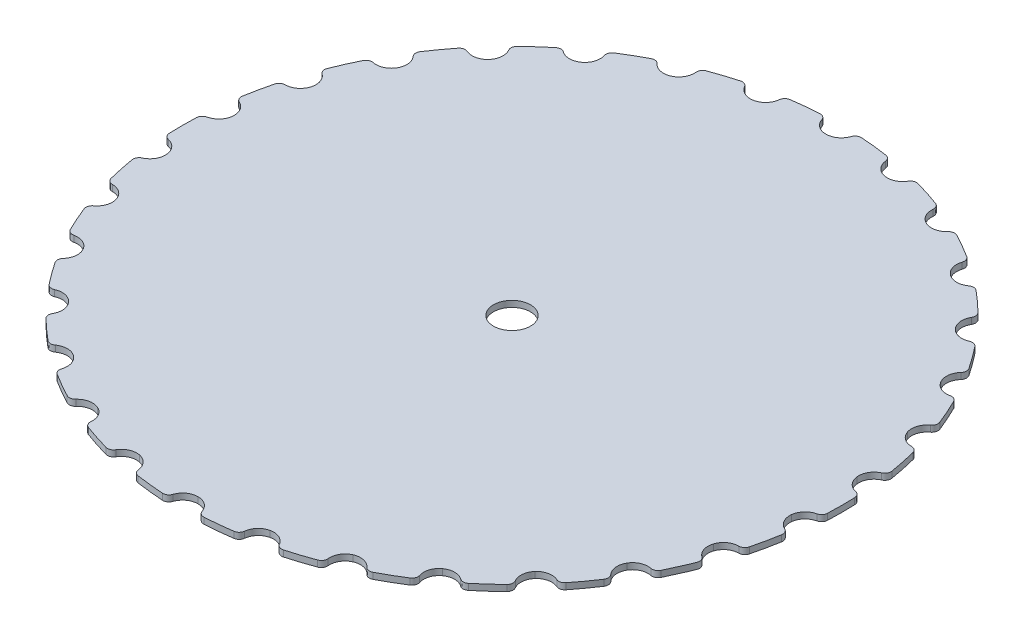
SolidWorks part; units mm, degrees
ref_plane "Front Plane" through (0, 0, 0) normal (0, 0, 1) x (1, 0, 0)
ref_plane "Top Plane" through (0, 0, 0) normal (0, 1, 0) x (1, 0, 0)
ref_plane "Right Plane" through (0, 0, 0) normal (1, 0, 0) x (0, 0, -1)
sketch "Sketch1" plane through (0, 0, 0) normal (0, 1, 0) x (1, 0, 0)
  circle A0 centre (6.5945, 0.258) radius 3
  ellipse E0 centre (6.5945, 0.258) end of major axis (6.5945, 3.258) minor radius 3 construction
  spline S0 degree 3 poles (-30.729, 38.4268) (-29.6819, 39.4503) (-28.5937, 40.4313) (-27.4664, 41.3656) (-27.1101, 41.6609) (-26.6154, 41.6768) (-26.2409, 41.405) knots 0.986667 0.986667 0.986667 0.986667 0.993333 0.993333 0.993333 1 1 1 1
  spline S1 degree 3 poles (-30.8964, 37.2123) (-31.1274, 37.6132) (-31.0598, 38.1034) (-30.729, 38.4268) knots 0.98 0.98 0.98 0.98 0.986667 0.986667 0.986667 0.986667
  spline S2 degree 3 poles (-31.2051, 34.2913) (-30.4625, 35.1163) (-30.3707, 36.2999) (-30.8964, 37.2123) knots 0.973333 0.973333 0.973333 0.973333 0.98 0.98 0.98 0.98
  spline S3 degree 3 poles (-35.274, 33.3879) (-34.9865, 33.7513) (-34.5051, 33.8694) (-34.082, 33.6805) (-33.1189, 33.2505) (-31.949, 33.4652) (-31.2051, 34.2913) knots 0.96 0.96 0.96 0.96 0.966667 0.966667 0.966667 0.973333 0.973333 0.973333 0.973333
  spline S4 degree 3 poles (-37.8517, 29.8338) (-37.0459, 31.0474) (-36.187, 32.2337) (-35.274, 33.3879) knots 0.953333 0.953333 0.953333 0.953333 0.96 0.96 0.96 0.96
  spline S5 degree 3 poles (-37.7617, 28.6114) (-38.0713, 28.9552) (-38.1076, 29.4484) (-37.8517, 29.8338) knots 0.946667 0.946667 0.946667 0.946667 0.953333 0.953333 0.953333 0.953333
  spline S6 degree 3 poles (-37.455, 25.6887) (-36.8997, 26.6506) (-37.0564, 27.8284) (-37.7617, 28.6114) knots 0.94 0.94 0.94 0.94 0.946667 0.946667 0.946667 0.946667
  spline S7 degree 3 poles (-40.1346, 24.4915) (-39.1054, 24.2749) (-38.0095, 24.7282) (-37.455, 25.6887) knots 0.933333 0.933333 0.933333 0.933333 0.94 0.94 0.94 0.94
  spline S8 degree 3 poles (-41.2374, 23.9554) (-41.0326, 24.3705) (-40.5875, 24.5868) (-40.1346, 24.4915) knots 0.926667 0.926667 0.926667 0.926667 0.933333 0.933333 0.933333 0.933333
  spline S9 degree 3 poles (-43.0169, 19.9362) (-42.4804, 21.2962) (-41.8875, 22.6375) (-41.2374, 23.9554) knots 0.92 0.92 0.92 0.92 0.926667 0.926667 0.926667 0.926667
  spline S10 degree 3 poles (-41.7798, 15.9745) (-41.4379, 17.0269) (-41.832, 18.1421) (-42.6781, 18.7629) (-43.0495, 19.0354) (-43.1859, 19.5077) (-43.0169, 19.9362) knots 0.906667 0.906667 0.906667 0.906667 0.913333 0.913333 0.913333 0.92 0.92 0.92 0.92
  spline S11 degree 3 poles (-44.1383, 14.2464) (-43.0915, 14.2541) (-42.1209, 14.9243) (-41.7798, 15.9745) knots 0.9 0.9 0.9 0.9 0.906667 0.906667 0.906667 0.906667
  spline S12 degree 3 poles (-45.0998, 13.4933) (-44.986, 13.9398) (-44.5989, 14.2429) (-44.1383, 14.2464) knots 0.893333 0.893333 0.893333 0.893333 0.9 0.9 0.9 0.9
  spline S13 degree 3 poles (-46.011, 9.187) (-45.7664, 10.6331) (-45.4624, 12.0698) (-45.0998, 13.4933) knots 0.886667 0.886667 0.886667 0.886667 0.893333 0.893333 0.893333 0.893333
  spline S14 degree 3 poles (-45.4396, 8.1102) (-45.8578, 8.3008) (-46.0877, 8.7338) (-46.011, 9.187) knots 0.88 0.88 0.88 0.88 0.886667 0.886667 0.886667 0.886667
  spline S15 degree 3 poles (-43.9903, 5.5735) (-43.8751, 6.6705) (-44.4879, 7.6767) (-45.4396, 8.1102) knots 0.873333 0.873333 0.873333 0.873333 0.88 0.88 0.88 0.88
  spline S16 degree 3 poles (-45.9348, 3.3935) (-44.9142, 3.6199) (-44.1056, 4.4764) (-43.9903, 5.5735) knots 0.866667 0.866667 0.866667 0.866667 0.873333 0.873333 0.873333 0.873333
  spline S17 degree 3 poles (-46.7175, 2.4591) (-46.6982, 2.9183) (-46.3835, 3.294) (-45.9348, 3.3935) knots 0.86 0.86 0.86 0.86 0.866667 0.866667 0.866667 0.866667
  spline S18 degree 3 poles (-46.7215, -1.9428) (-46.7801, -0.475) (-46.7789, 0.9937) (-46.7175, 2.4591) knots 0.853333 0.853333 0.853333 0.853333 0.86 0.86 0.86 0.86
  spline S19 degree 3 poles (-45.9377, -2.8794) (-46.3875, -2.7802) (-46.7031, -2.4031) (-46.7215, -1.9428) knots 0.846667 0.846667 0.846667 0.846667 0.853333 0.853333 0.853333 0.853333
  spline S20 degree 3 poles (-43.99, -5.0598) (-44.1055, -3.9618) (-44.9156, -3.1047) (-45.9377, -2.8794) knots 0.84 0.84 0.84 0.84 0.846667 0.846667 0.846667 0.846667
  spline S21 degree 3 poles (-45.4489, -7.6011) (-44.4919, -7.1699) (-43.8744, -6.1608) (-43.99, -5.0598) knots 0.833333 0.833333 0.833333 0.833333 0.84 0.84 0.84 0.84
  spline S22 degree 3 poles (-46.0244, -8.6785) (-46.1007, -8.2242) (-45.869, -7.7903) (-45.4489, -7.6011) knots 0.826667 0.826667 0.826667 0.826667 0.833333 0.833333 0.833333 0.833333
  spline S23 degree 3 poles (-45.1181, -12.9794) (-45.4801, -11.5553) (-45.7824, -10.1202) (-46.0244, -8.6785) knots 0.82 0.82 0.82 0.82 0.826667 0.826667 0.826667 0.826667
  spline S24 degree 3 poles (-44.151, -13.7328) (-44.6137, -13.7318) (-45.0041, -13.4277) (-45.1181, -12.9794) knots 0.813333 0.813333 0.813333 0.813333 0.82 0.82 0.82 0.82
  spline S25 degree 3 poles (-41.7789, -15.4608) (-42.1217, -14.4062) (-43.0991, -13.735) (-44.151, -13.7328) knots 0.806667 0.806667 0.806667 0.806667 0.813333 0.813333 0.813333 0.813333
  spline S26 degree 3 poles (-42.6873, -18.2567) (-41.8342, -17.6374) (-41.4356, -16.5176) (-41.7789, -15.4608) knots 0.8 0.8 0.8 0.8 0.806667 0.806667 0.806667 0.806667
  spline S27 degree 3 poles (-43.0295, -19.434) (-43.1998, -19.0037) (-43.0618, -18.5286) (-42.6873, -18.2567) knots 0.793333 0.793333 0.793333 0.793333 0.8 0.8 0.8 0.8
  spline S28 degree 3 poles (-41.2452, -23.4453) (-41.8987, -22.1268) (-42.4933, -20.7882) (-43.0295, -19.434) knots 0.786667 0.786667 0.786667 0.786667 0.793333 0.793333 0.793333 0.793333
  spline S29 degree 3 poles (-40.1404, -23.9792) (-40.5934, -24.0759) (-41.0396, -23.8603) (-41.2452, -23.4453) knots 0.78 0.78 0.78 0.78 0.786667 0.786667 0.786667 0.786667
  spline S30 degree 3 poles (-37.4537, -25.1746) (-38.0095, -24.2122) (-39.109, -23.7591) (-40.1404, -23.9792) knots 0.773333 0.773333 0.773333 0.773333 0.78 0.78 0.78 0.78
  spline S31 degree 3 poles (-37.76, -28.0974) (-37.055, -27.3142) (-36.8985, -26.1366) (-37.4537, -25.1746) knots 0.766667 0.766667 0.766667 0.766667 0.773333 0.773333 0.773333 0.773333
  spline S32 degree 3 poles (-37.8487, -29.3214) (-38.1058, -28.936) (-38.07, -28.4417) (-37.76, -28.0974) knots 0.76 0.76 0.76 0.76 0.766667 0.766667 0.766667 0.766667
  spline S33 degree 3 poles (-35.2635, -32.8705) (-36.1744, -31.7202) (-37.0343, -30.542) (-37.8487, -29.3214) knots 0.753333 0.753333 0.753333 0.753333 0.76 0.76 0.76 0.76
  spline S34 degree 3 poles (-34.0743, -33.1639) (-34.4969, -33.3512) (-34.9766, -33.2329) (-35.2635, -32.8705) knots 0.746667 0.746667 0.746667 0.746667 0.753333 0.753333 0.753333 0.753333
  spline S35 degree 3 poles (-31.2033, -33.777) (-31.9458, -32.9528) (-33.1123, -32.7374) (-34.0743, -33.1639) knots 0.74 0.74 0.74 0.74 0.746667 0.746667 0.746667 0.746667
  spline S36 degree 3 poles (-30.7285, -37.9137) (-31.0591, -37.5901) (-31.1263, -37.1) (-30.8951, -36.6993) (-30.3686, -35.7868) (-30.4602, -34.6026) (-31.2033, -33.777) knots 0.726667 0.726667 0.726667 0.726667 0.733333 0.733333 0.733333 0.74 0.74 0.74 0.74
  spline S37 degree 3 poles (-27.4666, -40.8529) (-28.5865, -39.9246) (-29.6752, -38.9448) (-30.7285, -37.9137) knots 0.72 0.72 0.72 0.72 0.726667 0.726667 0.726667 0.726667
  spline S38 degree 3 poles (-26.2405, -40.8918) (-26.615, -41.1641) (-27.1101, -41.1484) (-27.4666, -40.8529) knots 0.713333 0.713333 0.713333 0.713333 0.72 0.72 0.72 0.72
  spline S39 degree 3 poles (-23.3011, -40.8919) (-24.1999, -40.2391) (-25.3879, -40.2719) (-26.2405, -40.8918) knots 0.706667 0.706667 0.706667 0.706667 0.713333 0.713333 0.713333 0.713333
  spline S40 degree 3 poles (-21.9756, -44.8409) (-22.3672, -44.5934) (-22.5354, -44.1273) (-22.3922, -43.6867) (-22.0665, -42.6846) (-22.4024, -41.545) (-23.3011, -40.8919) knots 0.693333 0.693333 0.693333 0.693333 0.7 0.7 0.7 0.706667 0.706667 0.706667 0.706667
  spline S41 degree 3 poles (-18.1687, -47.0319) (-19.4625, -46.357) (-20.7328, -45.6266) (-21.9756, -44.8409) knots 0.686667 0.686667 0.686667 0.686667 0.693333 0.693333 0.693333 0.693333
  spline S42 degree 3 poles (-16.9642, -46.8157) (-17.2738, -47.1583) (-17.7593, -47.2455) (-18.1687, -47.0319) knots 0.68 0.68 0.68 0.68 0.686667 0.686667 0.686667 0.686667
  spline S43 degree 3 poles (-14.0922, -46.2083) (-15.1056, -45.7573) (-16.2588, -46.0349) (-16.9642, -46.8157) knots 0.673333 0.673333 0.673333 0.673333 0.68 0.68 0.68 0.68
  spline S44 degree 3 poles (-12.6208, -48.7404) (-12.5165, -47.6968) (-13.0815, -46.6585) (-14.0922, -46.2083) knots 0.666667 0.666667 0.666667 0.666667 0.673333 0.673333 0.673333 0.673333
  spline S45 degree 3 poles (-11.972, -49.778) (-12.4051, -49.6181) (-12.6666, -49.1998) (-12.6208, -48.7404) knots 0.66 0.66 0.66 0.66 0.666667 0.666667 0.666667 0.666667
  spline S46 degree 3 poles (-7.786, -51.1305) (-9.1969, -50.7377) (-10.5936, -50.2867) (-11.972, -49.778) knots 0.653333 0.653333 0.653333 0.653333 0.66 0.66 0.66 0.66
  spline S47 degree 3 poles (-6.6554, -50.6733) (-6.8882, -51.0699) (-7.343, -51.2538) (-7.786, -51.1305) knots 0.646667 0.646667 0.646667 0.646667 0.653333 0.653333 0.653333 0.653333
  spline S48 degree 3 poles (-3.9792, -49.494) (-5.0596, -49.2645) (-6.1253, -49.7704) (-6.6554, -50.6733) knots 0.64 0.64 0.64 0.64 0.646667 0.646667 0.646667 0.646667
  spline S49 degree 3 poles (-2.0144, -51.6557) (-2.1328, -50.617) (-2.9001, -49.7233) (-3.9792, -49.494) knots 0.633333 0.633333 0.633333 0.633333 0.64 0.64 0.64 0.64
  spline S50 degree 3 poles (-1.166, -52.5319) (-1.6211, -52.4651) (-1.9623, -52.1127) (-2.0144, -51.6557) knots 0.626667 0.626667 0.626667 0.626667 0.633333 0.633333 0.633333 0.633333
  spline S51 degree 3 poles (3.2123, -52.9924) (1.7473, -52.8986) (0.2864, -52.745) (-1.166, -52.5319) knots 0.62 0.62 0.62 0.62 0.626667 0.626667 0.626667 0.626667
  spline S52 degree 3 poles (4.2244, -52.3117) (4.0785, -52.7479) (3.6713, -53.0218) (3.2123, -52.9924) knots 0.613333 0.613333 0.613333 0.613333 0.62 0.62 0.62 0.62
  spline S53 degree 3 poles (6.5959, -50.6052) (5.4926, -50.6053) (4.5562, -51.3199) (4.2244, -52.3117) knots 0.606667 0.606667 0.606667 0.606667 0.613333 0.613333 0.613333 0.613333
  spline S54 degree 3 poles (8.9689, -52.316) (8.6386, -51.322) (7.7009, -50.6053) (6.5959, -50.6052) knots 0.6 0.6 0.6 0.6 0.606667 0.606667 0.606667 0.606667
  spline S55 degree 3 poles (9.9798, -52.9988) (9.5207, -53.0273) (9.1141, -52.7526) (8.9689, -52.316) knots 0.593333 0.593333 0.593333 0.593333 0.6 0.6 0.6 0.6
  spline S56 degree 3 poles (14.3547, -52.5464) (12.901, -52.7573) (11.4412, -52.9081) (9.9798, -52.9988) knots 0.586667 0.586667 0.586667 0.586667 0.593333 0.593333 0.593333 0.593333
  spline S57 degree 3 poles (15.2051, -51.6659) (15.1547, -52.125) (14.8118, -52.4801) (14.3547, -52.5464) knots 0.58 0.58 0.58 0.58 0.586667 0.586667 0.586667 0.586667
  spline S58 degree 3 poles (17.171, -49.4934) (16.0883, -49.7235) (15.3195, -50.6225) (15.2051, -51.6659) knots 0.573333 0.573333 0.573333 0.573333 0.58 0.58 0.58 0.58
  spline S59 degree 3 poles (19.8545, -50.6853) (19.3272, -49.7744) (18.2565, -49.2627) (17.171, -49.4934) knots 0.566667 0.566667 0.566667 0.566667 0.573333 0.573333 0.573333 0.573333
  spline S60 degree 3 poles (20.9881, -51.1478) (20.543, -51.2716) (20.0859, -51.0852) (19.8545, -50.6853) knots 0.56 0.56 0.56 0.56 0.566667 0.566667 0.566667 0.566667
  spline S61 degree 3 poles (25.1664, -49.7959) (23.7878, -50.3059) (22.3936, -50.7566) (20.9881, -51.1478) knots 0.553333 0.553333 0.553333 0.553333 0.56 0.56 0.56 0.56
  spline S62 degree 3 poles (25.8138, -48.7531) (25.8625, -49.2139) (25.601, -49.6351) (25.1664, -49.7959) knots 0.546667 0.546667 0.546667 0.546667 0.553333 0.553333 0.553333 0.553333
  spline S63 degree 3 poles (27.2838, -46.2072) (26.2688, -46.6592) (25.7033, -47.7047) (25.8138, -48.7531) knots 0.54 0.54 0.54 0.54 0.546667 0.546667 0.546667 0.546667
  spline S64 degree 3 poles (30.1603, -46.8195) (29.4554, -46.0349) (28.2994, -45.7551) (27.2838, -46.2072) knots 0.533333 0.533333 0.533333 0.533333 0.54 0.54 0.54 0.54
  spline S65 degree 3 poles (31.3684, -47.0369) (30.9579, -47.252) (30.47, -47.1643) (30.1603, -46.8195) knots 0.526667 0.526667 0.526667 0.526667 0.533333 0.533333 0.533333 0.533333
  spline S66 degree 3 poles (35.1688, -44.8401) (33.9245, -45.6298) (32.6563, -46.362) (31.3684, -47.0369) knots 0.52 0.52 0.52 0.52 0.526667 0.526667 0.526667 0.526667
  spline S67 degree 3 poles (35.5839, -43.6863) (35.7271, -44.1264) (35.5596, -44.5921) (35.1688, -44.8401) knots 0.513333 0.513333 0.513333 0.513333 0.52 0.52 0.52 0.52
  spline S68 degree 3 poles (36.4923, -40.8903) (35.5935, -41.5436) (35.2578, -42.6837) (35.5839, -43.6863) knots 0.506667 0.506667 0.506667 0.506667 0.513333 0.513333 0.513333 0.513333
  spline S69 degree 3 poles (39.43, -40.8887) (38.5777, -40.27) (37.3907, -40.2377) (36.4923, -40.8903) knots 0.5 0.5 0.5 0.5 0.506667 0.506667 0.506667 0.506667
  spline S70 degree 3 poles (40.6555, -40.8494) (40.2992, -41.1447) (39.8045, -41.1606) (39.43, -40.8887) knots 0.493333 0.493333 0.493333 0.493333 0.5 0.5 0.5 0.5
  spline S71 degree 3 poles (43.918, -37.9106) (42.8709, -38.9339) (41.7827, -39.9152) (40.6555, -40.8494) knots 0.486667 0.486667 0.486667 0.486667 0.493333 0.493333 0.493333 0.493333
  spline S72 degree 3 poles (44.0854, -36.6962) (44.3164, -37.0971) (44.2489, -37.5872) (43.918, -37.9106) knots 0.48 0.48 0.48 0.48 0.486667 0.486667 0.486667 0.486667
  spline S73 degree 3 poles (44.3943, -33.775) (43.6516, -34.6001) (43.5596, -35.7838) (44.0854, -36.6962) knots 0.473333 0.473333 0.473333 0.473333 0.48 0.48 0.48 0.48
  spline S74 degree 3 poles (47.2711, -33.1643) (46.3079, -32.7342) (45.1382, -32.9489) (44.3943, -33.775) knots 0.466667 0.466667 0.466667 0.466667 0.473333 0.473333 0.473333 0.473333
  spline S75 degree 3 poles (48.4631, -32.8716) (48.1756, -33.235) (47.6942, -33.3532) (47.2711, -33.1643) knots 0.46 0.46 0.46 0.46 0.466667 0.466667 0.466667 0.466667
  spline S76 degree 3 poles (51.0407, -29.3178) (50.2349, -30.5312) (49.3761, -31.7175) (48.4631, -32.8716) knots 0.453333 0.453333 0.453333 0.453333 0.46 0.46 0.46 0.46
  spline S77 degree 3 poles (50.9507, -28.0954) (51.2603, -28.4391) (51.2966, -28.9324) (51.0407, -29.3178) knots 0.446667 0.446667 0.446667 0.446667 0.453333 0.453333 0.453333 0.453333
  spline S78 degree 3 poles (50.6441, -25.1723) (50.0888, -26.1344) (50.2455, -27.3123) (50.9507, -28.0954) knots 0.44 0.44 0.44 0.44 0.446667 0.446667 0.446667 0.446667
  spline S79 degree 3 poles (53.3236, -23.9753) (52.2943, -23.7586) (51.1987, -24.2119) (50.6441, -25.1723) knots 0.433333 0.433333 0.433333 0.433333 0.44 0.44 0.44 0.44
  spline S80 degree 3 poles (54.4264, -23.4391) (54.2216, -23.8542) (53.7765, -24.0705) (53.3236, -23.9753) knots 0.426667 0.426667 0.426667 0.426667 0.433333 0.433333 0.433333 0.433333
  spline S81 degree 3 poles (54.9689, -15.4582) (54.627, -16.5108) (55.0208, -17.6261) (55.867, -18.2469) (56.2383, -18.5193) (56.3748, -18.9917) (56.2058, -19.4201) (55.6693, -20.7801) (55.0765, -22.1213) (54.4264, -23.4391) knots 0.406667 0.406667 0.406667 0.406667 0.413333 0.413333 0.413333 0.42 0.42 0.42 0.426667 0.426667 0.426667 0.426667
  spline S82 degree 3 poles (57.3272, -13.7302) (56.2805, -13.738) (55.3102, -14.408) (54.9689, -15.4582) knots 0.4 0.4 0.4 0.4 0.406667 0.406667 0.406667 0.406667
  spline S83 degree 3 poles (58.2888, -12.9771) (58.1751, -13.4235) (57.7879, -13.7267) (57.3272, -13.7302) knots 0.393333 0.393333 0.393333 0.393333 0.4 0.4 0.4 0.4
  spline S84 degree 3 poles (59.2, -8.6709) (58.9553, -10.117) (58.6514, -11.5537) (58.2888, -12.9771) knots 0.386667 0.386667 0.386667 0.386667 0.393333 0.393333 0.393333 0.393333
  spline S85 degree 3 poles (58.6287, -7.5941) (59.0469, -7.7847) (59.2767, -8.2177) (59.2, -8.6709) knots 0.38 0.38 0.38 0.38 0.386667 0.386667 0.386667 0.386667
  spline S86 degree 3 poles (57.1794, -5.0572) (57.0642, -6.1544) (57.677, -7.1605) (58.6287, -7.5941) knots 0.373333 0.373333 0.373333 0.373333 0.38 0.38 0.38 0.38
  spline S87 degree 3 poles (59.1238, -2.8772) (58.1031, -3.1035) (57.2948, -3.9601) (57.1794, -5.0572) knots 0.366667 0.366667 0.366667 0.366667 0.373333 0.373333 0.373333 0.373333
  spline S88 degree 3 poles (59.9065, -1.9429) (59.8872, -2.4021) (59.5725, -2.7777) (59.1238, -2.8772) knots 0.36 0.36 0.36 0.36 0.366667 0.366667 0.366667 0.366667
  spline S89 degree 3 poles (59.9105, 2.4589) (59.9691, 0.9911) (59.9679, -0.4776) (59.9065, -1.9429) knots 0.353333 0.353333 0.353333 0.353333 0.36 0.36 0.36 0.36
  spline S90 degree 3 poles (59.1267, 3.3955) (59.5765, 3.2963) (59.8921, 2.9192) (59.9105, 2.4589) knots 0.346667 0.346667 0.346667 0.346667 0.353333 0.353333 0.353333 0.353333
  spline S91 degree 3 poles (57.1791, 5.5761) (57.2945, 4.478) (58.1046, 3.6209) (59.1267, 3.3955) knots 0.34 0.34 0.34 0.34 0.346667 0.346667 0.346667 0.346667
  spline S92 degree 3 poles (58.6379, 8.1173) (57.6809, 7.6862) (57.0634, 6.677) (57.1791, 5.5761) knots 0.333333 0.333333 0.333333 0.333333 0.34 0.34 0.34 0.34
  spline S93 degree 3 poles (59.2134, 9.1947) (59.2897, 8.7403) (59.058, 8.3065) (58.6379, 8.1173) knots 0.326667 0.326667 0.326667 0.326667 0.333333 0.333333 0.333333 0.333333
  spline S94 degree 3 poles (58.3071, 13.4955) (58.6692, 12.0714) (58.9713, 10.6364) (59.2134, 9.1947) knots 0.32 0.32 0.32 0.32 0.326667 0.326667 0.326667 0.326667
  spline S95 degree 3 poles (57.3401, 14.249) (57.8028, 14.248) (58.1931, 13.9439) (58.3071, 13.4955) knots 0.313333 0.313333 0.313333 0.313333 0.32 0.32 0.32 0.32
  spline S96 degree 3 poles (54.968, 15.9771) (55.3107, 14.9225) (56.2882, 14.2511) (57.3401, 14.249) knots 0.306667 0.306667 0.306667 0.306667 0.313333 0.313333 0.313333 0.313333
  spline S97 degree 3 poles (55.8763, 18.7729) (55.0231, 18.1537) (54.6246, 17.0338) (54.968, 15.9771) knots 0.3 0.3 0.3 0.3 0.306667 0.306667 0.306667 0.306667
  spline S98 degree 3 poles (56.2187, 19.9503) (56.3891, 19.5199) (56.2509, 19.0448) (55.8763, 18.7729) knots 0.293333 0.293333 0.293333 0.293333 0.3 0.3 0.3 0.3
  spline S99 degree 3 poles (54.4343, 23.9616) (55.0878, 22.643) (55.6826, 21.3046) (56.2187, 19.9503) knots 0.286667 0.286667 0.286667 0.286667 0.293333 0.293333 0.293333 0.293333
  spline S100 degree 3 poles (53.3295, 24.4954) (53.7825, 24.5922) (54.2286, 24.3766) (54.4343, 23.9616) knots 0.28 0.28 0.28 0.28 0.286667 0.286667 0.286667 0.286667
  spline S101 degree 3 poles (50.6428, 25.691) (51.1986, 24.7284) (52.2982, 24.2752) (53.3295, 24.4954) knots 0.273333 0.273333 0.273333 0.273333 0.28 0.28 0.28 0.28
  spline S102 degree 3 poles (50.9492, 28.6138) (50.244, 27.8307) (50.0873, 26.653) (50.6428, 25.691) knots 0.266667 0.266667 0.266667 0.266667 0.273333 0.273333 0.273333 0.273333
  spline S103 degree 3 poles (51.0382, 29.8376) (51.2951, 29.4522) (51.2592, 28.958) (50.9492, 28.6138) knots 0.26 0.26 0.26 0.26 0.266667 0.266667 0.266667 0.266667
  spline S104 degree 3 poles (48.4548, 33.3879) (49.3642, 32.2402) (50.2259, 31.0561) (51.0382, 29.8376) knots 0.253333 0.253333 0.253333 0.253333 0.26 0.26 0.26 0.26
  spline S105 degree 3 poles (47.2651, 33.6807) (47.6877, 33.8684) (48.1677, 33.7503) (48.4548, 33.3879) knots 0.246667 0.246667 0.246667 0.246667 0.253333 0.253333 0.253333 0.253333
  spline S106 degree 3 poles (44.3925, 34.2933) (45.1352, 33.4685) (46.3028, 33.2532) (47.2651, 33.6807) knots 0.24 0.24 0.24 0.24 0.246667 0.246667 0.246667 0.246667
  spline S107 degree 3 poles (44.0845, 37.2161) (43.5575, 36.3035) (43.649, 35.1188) (44.3925, 34.2933) knots 0.233333 0.233333 0.233333 0.233333 0.24 0.24 0.24 0.24
  spline S108 degree 3 poles (43.918, 38.4307) (44.2487, 38.107) (44.3159, 37.6168) (44.0845, 37.2161) knots 0.226667 0.226667 0.226667 0.226667 0.233333 0.233333 0.233333 0.233333
  spline S109 degree 3 poles (40.6566, 41.3696) (41.7763, 40.4415) (42.8648, 39.4618) (43.918, 38.4307) knots 0.22 0.22 0.22 0.22 0.226667 0.226667 0.226667 0.226667
  spline S110 degree 3 poles (39.4302, 41.4083) (39.8048, 41.6808) (40.3, 41.6652) (40.6566, 41.3696) knots 0.213333 0.213333 0.213333 0.213333 0.22 0.22 0.22 0.22
  spline S111 degree 3 poles (36.4902, 41.4082) (37.3891, 40.7551) (38.5777, 40.7882) (39.4302, 41.4083) knots 0.206667 0.206667 0.206667 0.206667 0.213333 0.213333 0.213333 0.213333
  spline S112 degree 3 poles (35.5813, 44.2029) (35.2556, 43.2007) (35.5914, 42.0611) (36.4902, 41.4082) knots 0.2 0.2 0.2 0.2 0.206667 0.206667 0.206667 0.206667
  spline S113 degree 3 poles (35.1647, 45.3571) (35.5562, 45.1095) (35.7244, 44.6434) (35.5813, 44.2029) knots 0.193333 0.193333 0.193333 0.193333 0.2 0.2 0.2 0.2
  spline S114 degree 3 poles (31.3581, 47.5484) (32.6518, 46.8734) (33.9219, 46.1427) (35.1647, 45.3571) knots 0.186667 0.186667 0.186667 0.186667 0.193333 0.193333 0.193333 0.193333
  spline S115 degree 3 poles (30.1534, 47.3321) (30.463, 47.6748) (30.9487, 47.7621) (31.3581, 47.5484) knots 0.18 0.18 0.18 0.18 0.186667 0.186667 0.186667 0.186667
  spline S116 degree 3 poles (27.2813, 46.7247) (28.2948, 46.2737) (29.448, 46.5513) (30.1534, 47.3321) knots 0.173333 0.173333 0.173333 0.173333 0.18 0.18 0.18 0.18
  spline S117 degree 3 poles (25.8099, 49.2573) (25.7052, 48.2133) (26.2703, 47.1746) (27.2813, 46.7247) knots 0.166667 0.166667 0.166667 0.166667 0.173333 0.173333 0.173333 0.173333
  spline S118 degree 3 poles (25.1612, 50.2953) (25.5945, 50.1353) (25.8559, 49.7169) (25.8099, 49.2573) knots 0.16 0.16 0.16 0.16 0.166667 0.166667 0.166667 0.166667
  spline S119 degree 3 poles (20.9756, 51.6476) (22.3864, 51.2549) (23.783, 50.8041) (25.1612, 50.2953) knots 0.153333 0.153333 0.153333 0.153333 0.16 0.16 0.16 0.16
  spline S120 degree 3 poles (19.8449, 51.1902) (20.0776, 51.5869) (20.5325, 51.7709) (20.9756, 51.6476) knots 0.146667 0.146667 0.146667 0.146667 0.153333 0.153333 0.153333 0.153333
  spline S121 degree 3 poles (17.1683, 50.0103) (18.249, 49.7806) (19.3149, 50.2868) (19.8449, 51.1902) knots 0.14 0.14 0.14 0.14 0.146667 0.146667 0.146667 0.146667
  spline S122 degree 3 poles (15.2035, 52.172) (15.3219, 51.1331) (16.089, 50.2395) (17.1683, 50.0103) knots 0.133333 0.133333 0.133333 0.133333 0.14 0.14 0.14 0.14
  spline S123 degree 3 poles (9.9765, 53.5084) (11.4417, 53.4148) (12.9025, 53.2611) (14.3551, 53.0482) (14.8102, 52.9815) (15.1514, 52.629) (15.2035, 52.172) knots 0.12 0.12 0.12 0.12 0.126667 0.126667 0.126667 0.133333 0.133333 0.133333 0.133333
  spline S124 degree 3 poles (8.9645, 52.8278) (9.1105, 53.2639) (9.5175, 53.5377) (9.9765, 53.5084) knots 0.113333 0.113333 0.113333 0.113333 0.12 0.12 0.12 0.12
  spline S125 degree 3 poles (4.2203, 52.8321) (4.5506, 51.8383) (5.4883, 51.1215) (6.5932, 51.1215) (7.6964, 51.1215) (8.6327, 51.8363) (8.9645, 52.8278) knots 0.1 0.1 0.1 0.1 0.106667 0.106667 0.106667 0.113333 0.113333 0.113333 0.113333
  spline S126 degree 3 poles (3.2093, 53.5148) (3.6684, 53.5433) (4.0752, 53.2686) (4.2203, 52.8321) knots 0.093333 0.093333 0.093333 0.093333 0.1 0.1 0.1 0.1
  spline S127 degree 3 poles (-1.1658, 53.0621) (0.288, 53.2731) (1.7478, 53.4241) (3.2093, 53.5148) knots 0.086667 0.086667 0.086667 0.086667 0.093333 0.093333 0.093333 0.093333
  spline S128 degree 3 poles (-2.0162, 52.1817) (-1.9658, 52.6408) (-1.6229, 52.9958) (-1.1658, 53.0621) knots 0.08 0.08 0.08 0.08 0.086667 0.086667 0.086667 0.086667
  spline S129 degree 3 poles (-3.9819, 50.0097) (-2.8995, 50.2399) (-2.1307, 51.1386) (-2.0162, 52.1817) knots 0.073333 0.073333 0.073333 0.073333 0.08 0.08 0.08 0.08
  spline S130 degree 3 poles (-6.6652, 51.2015) (-6.1378, 50.2906) (-5.0672, 49.779) (-3.9819, 50.0097) knots 0.066667 0.066667 0.066667 0.066667 0.073333 0.073333 0.073333 0.073333
  spline S131 degree 3 poles (-7.7986, 51.6636) (-7.3536, 51.7874) (-6.8967, 51.6012) (-6.6652, 51.2015) knots 0.06 0.06 0.06 0.06 0.066667 0.066667 0.066667 0.066667
  spline S132 degree 3 poles (-11.9774, 50.3116) (-10.5987, 50.8219) (-9.2044, 51.2724) (-7.7986, 51.6636) knots 0.053333 0.053333 0.053333 0.053333 0.06 0.06 0.06 0.06
  spline S133 degree 3 poles (-12.6248, 49.269) (-12.6734, 49.7298) (-12.4119, 50.1508) (-11.9774, 50.3116) knots 0.046667 0.046667 0.046667 0.046667 0.053333 0.053333 0.053333 0.053333
  spline S134 degree 3 poles (-14.0947, 46.7236) (-13.0798, 47.1755) (-12.5144, 48.2207) (-12.6248, 49.269) knots 0.04 0.04 0.04 0.04 0.046667 0.046667 0.046667 0.046667
  spline S135 degree 3 poles (-16.9711, 47.3357) (-16.2662, 46.5511) (-15.1102, 46.2714) (-14.0947, 46.7236) knots 0.033333 0.033333 0.033333 0.033333 0.04 0.04 0.04 0.04
  spline S136 degree 3 poles (-18.1791, 47.5531) (-17.7687, 47.7682) (-17.2808, 47.6804) (-16.9711, 47.3357) knots 0.026667 0.026667 0.026667 0.026667 0.033333 0.033333 0.033333 0.033333
  spline S137 degree 3 poles (-21.9797, 45.3562) (-20.7353, 46.1457) (-19.4671, 46.878) (-18.1791, 47.5531) knots 0.02 0.02 0.02 0.02 0.026667 0.026667 0.026667 0.026667
  spline S138 degree 3 poles (-22.3949, 44.2023) (-22.5381, 44.6424) (-22.3705, 45.1081) (-21.9797, 45.3562) knots 0.013333 0.013333 0.013333 0.013333 0.02 0.02 0.02 0.02
  spline S139 degree 3 poles (-23.3032, 41.4066) (-22.4043, 42.0597) (-22.0687, 43.2) (-22.3949, 44.2023) knots 0.006667 0.006667 0.006667 0.006667 0.013333 0.013333 0.013333 0.013333
  spline S140 degree 3 poles (-26.2409, 41.405) (-25.3885, 40.7865) (-24.2014, 40.754) (-23.3032, 41.4066) knots 0 0 0 0 0.006667 0.006667 0.006667 0.006667
extrude "Boss-Extrude1" add sketch "Sketch1" along normal blind 1
